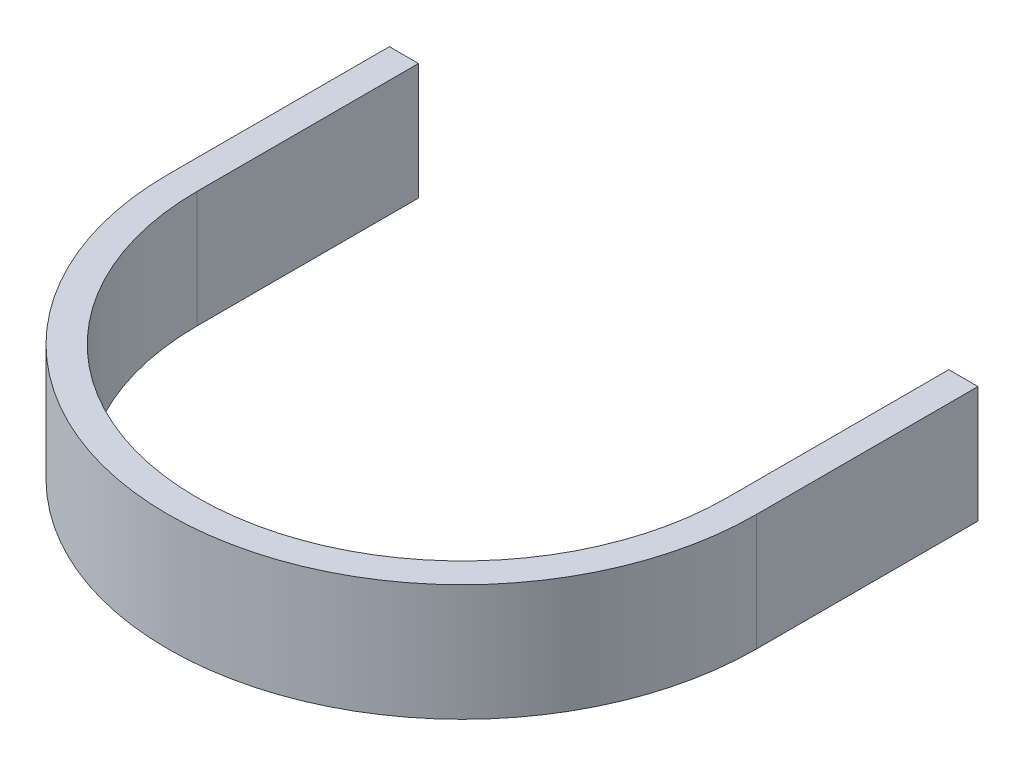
SolidWorks part; units mm, degrees
ref_plane "Plan de face" through (0, 0, 0) normal (0, 0, 1) x (1, 0, 0)
ref_plane "Plan de dessus" through (0, 0, 0) normal (0, 1, 0) x (1, 0, 0)
ref_plane "Plan de droite" through (0, 0, 0) normal (1, 0, 0) x (0, 0, -1)
sketch "Esquisse1" plane through (0, 0, 0) normal (0, 1, 0) x (1, 0, 0)
  line L0 (-9.5022, 0) -> (78.0576, 0) construction
  line L1 (53.2967, 0) -> (53.2967, 52.7511) construction
  line L2 (50.5, -30) -> (50.5, 8)
  line L3 (0, -36.9756) -> (0, 41.4803) construction
  line L4 (45.5, 41.4803) -> (45.5, -71.2706) construction
  line L5 (65.4792, -30) -> (-63.2154, -30) construction
  line L6 (50.5, 8) -> (45.5, 8)
  line L7 (78.0576, 8) -> (30, 8) construction
  line L8 (-50.5, -30) -> (-50.5, 8)
  line L9 (-50.5, 8) -> (-45.5, 8)
  line L14 (45.5, 8) -> (45.5, -30)
  line L15 (-45.5, 8) -> (-45.5, -30)
  arc A0 (-45.5, -30) -> (45.5, -30) centre (0, -30) ccw
  arc A8 (-50.5, -30) -> (50.5, -30) centre (0, -30) ccw
  dimension "D4" = 30
  dimension "D6" = 8
extrude "Boss.-Extru.1" add sketch "Esquisse1" along normal blind 20
